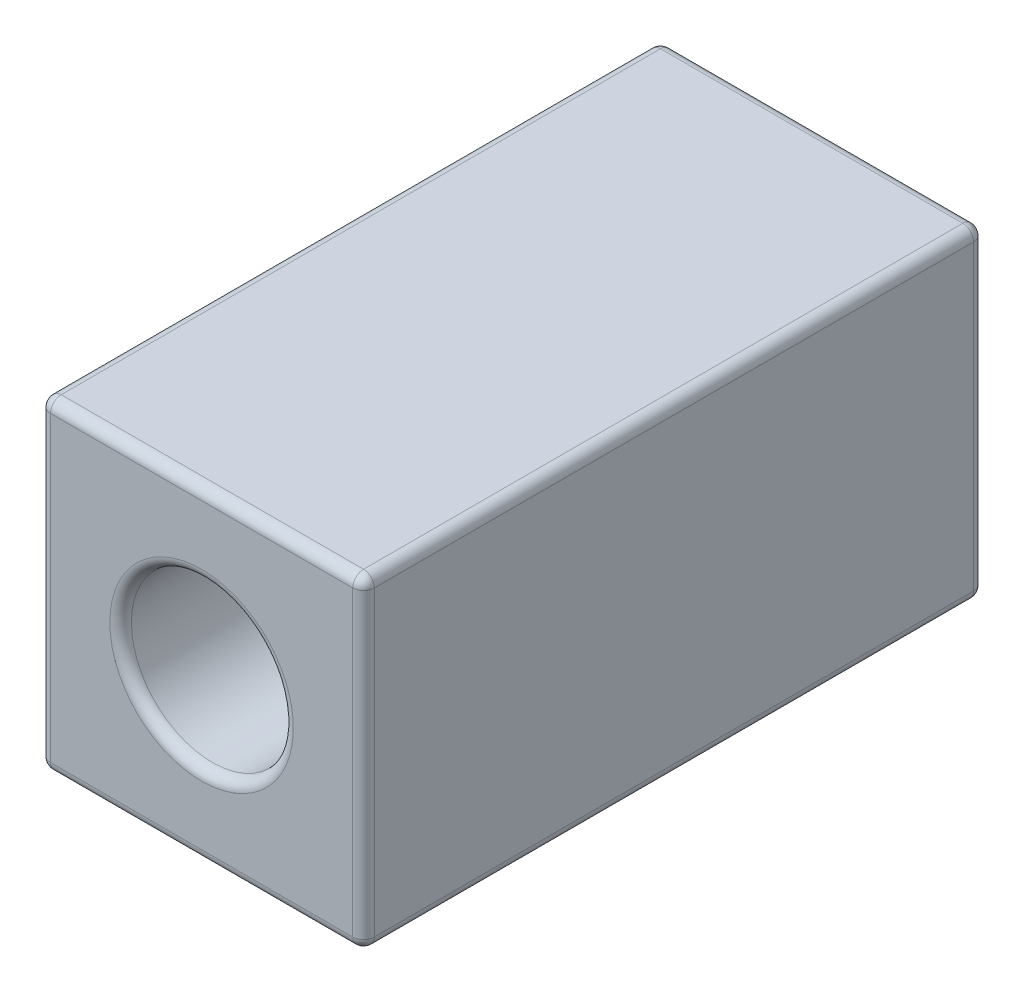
SolidWorks part; units mm, degrees
ref_plane "Face" through (0, 0, 0) normal (0, 0, 1) x (1, 0, 0)
ref_plane "Dessus" through (0, 0, 0) normal (0, 1, 0) x (1, 0, 0)
ref_plane "Droite" through (0, 0, 0) normal (1, 0, 0) x (0, 0, -1)
sketch "Esquisse1" plane through (0, 0, 0) normal (0, 0, 1) x (1, 0, 0)
  line L1 (-2.8, 3) -> (2.8, 3)
  line L2 (-3, 2.8) -> (-3, -2.8)
  line L3 (-2.8, -3) -> (2.8, -3)
  line L4 (3, 2.8) -> (3, -2.8)
  circle A0 centre (0, 0) radius 1.5
  arc A1 (-3, 2.8) -> (-2.8, 3) centre (-2.8, 2.8) cw
  arc A2 (-2.8, -3) -> (-3, -2.8) centre (-2.8, -2.8) cw
  arc A3 (3, -2.8) -> (2.8, -3) centre (2.8, -2.8) cw
  arc A4 (3, 2.8) -> (2.8, 3) centre (2.8, 2.8) ccw
  point P8 (-3, 3)
  point P11 (-3, -3)
  point P14 (3, -3)
  dimension "D5" = 3
  dimension "D6" = 0.2
  dimension "D1" = 3
  dimension "D2" = 6
  dimension "D3" = 3
  dimension "D4" = 6
extrude "Extrusion1" add sketch "Esquisse1" along normal blind 11.5
fillet "Congé1" radius 0.2
